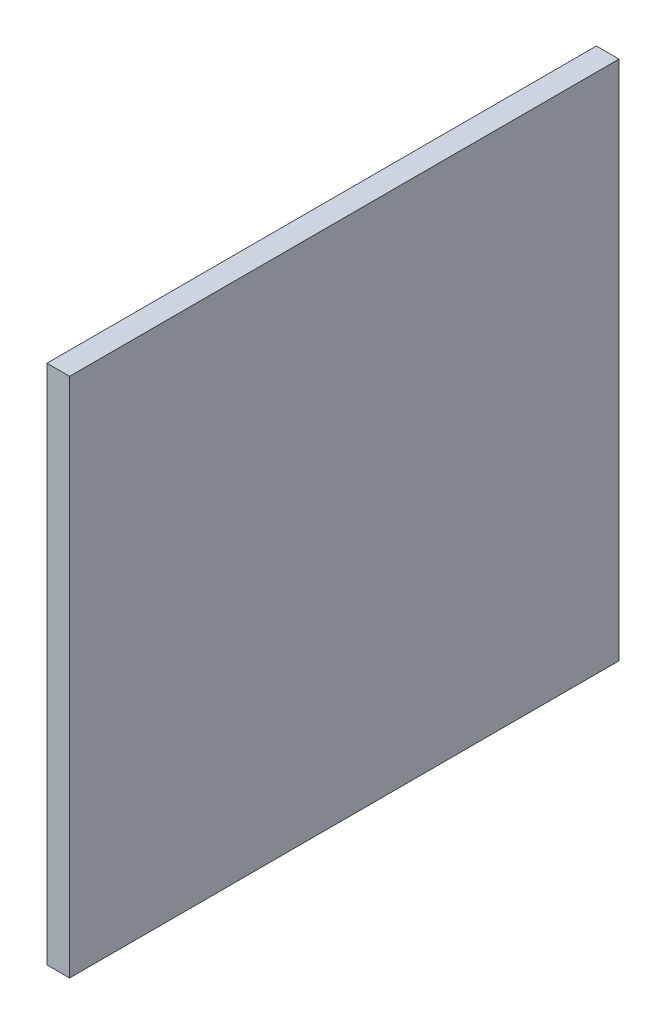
SolidWorks part; units mm, degrees
ref_plane "Alzado" through (0, 0, 0) normal (0, 0, 1) x (1, 0, 0)
ref_plane "Planta" through (0, 0, 0) normal (0, 1, 0) x (1, 0, 0)
ref_plane "Vista lateral" through (0, 0, 0) normal (1, 0, 0) x (0, 0, -1)
sketch "Croquis1" plane through (0, 0, 0) normal (1, 0, 0) x (0, 0, -1)
  line L1 (0, 0) -> (970, 0)
  line L2 (0, 0) -> (0, 920)
  line L3 (0, 920) -> (970, 920)
  line L4 (970, 0) -> (970, 920)
  dimension "D1" = 920
  dimension "D2" = 970
extrude "Saliente-Extruir1" add sketch "Croquis1" along normal blind 40
